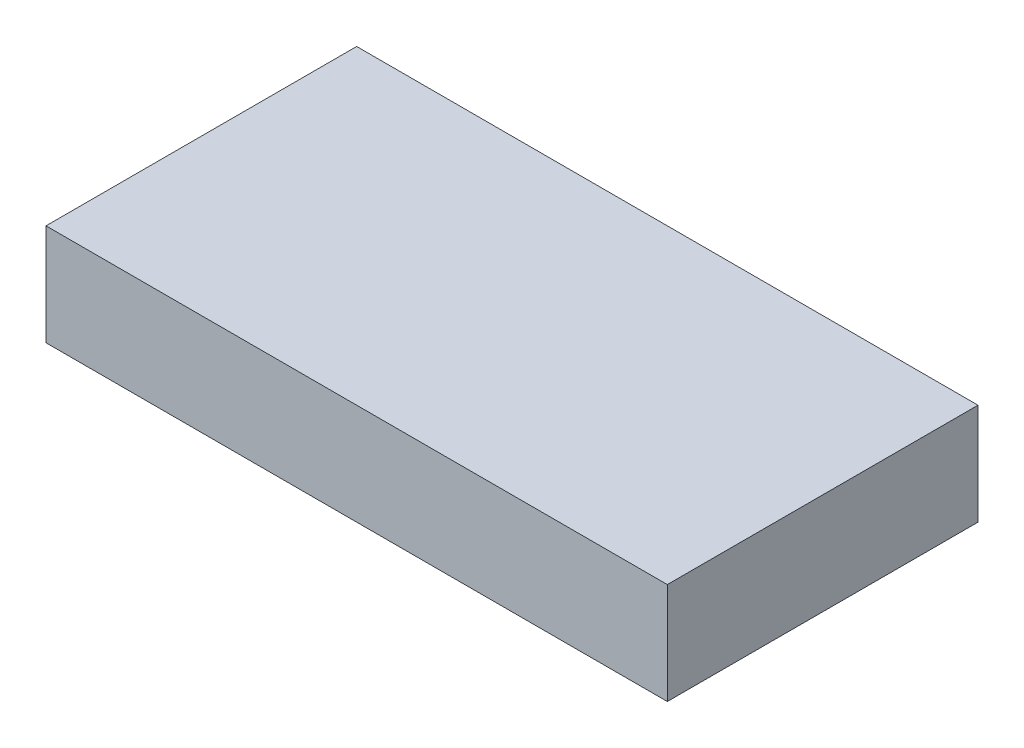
SolidWorks part; units mm, degrees
ref_plane "Front Plane" through (0, 0, 0) normal (0, 0, 1) x (1, 0, 0)
ref_plane "Top Plane" through (0, 0, 0) normal (0, 1, 0) x (1, 0, 0)
ref_plane "Right Plane" through (0, 0, 0) normal (1, 0, 0) x (0, 0, -1)
sketch "Sketch1" plane through (0, 0, 0) normal (0, 1, 0) x (1, 0, 0)
  line L1 (-115, 57.5) -> (115, 57.5)
  line L2 (-115, 57.5) -> (-115, -57.5)
  line L3 (-115, -57.5) -> (115, -57.5)
  line L4 (115, 57.5) -> (115, -57.5)
  line L5 (-115, 57.5) -> (115, -57.5) construction
  line L6 (-115, -57.5) -> (115, 57.5) construction
  point P0 (0, 0)
  dimension "D1" = 230
  dimension "D2" = 115
extrude "Boss-Extrude1" add sketch "Sketch1" along normal mid plane 37.5
